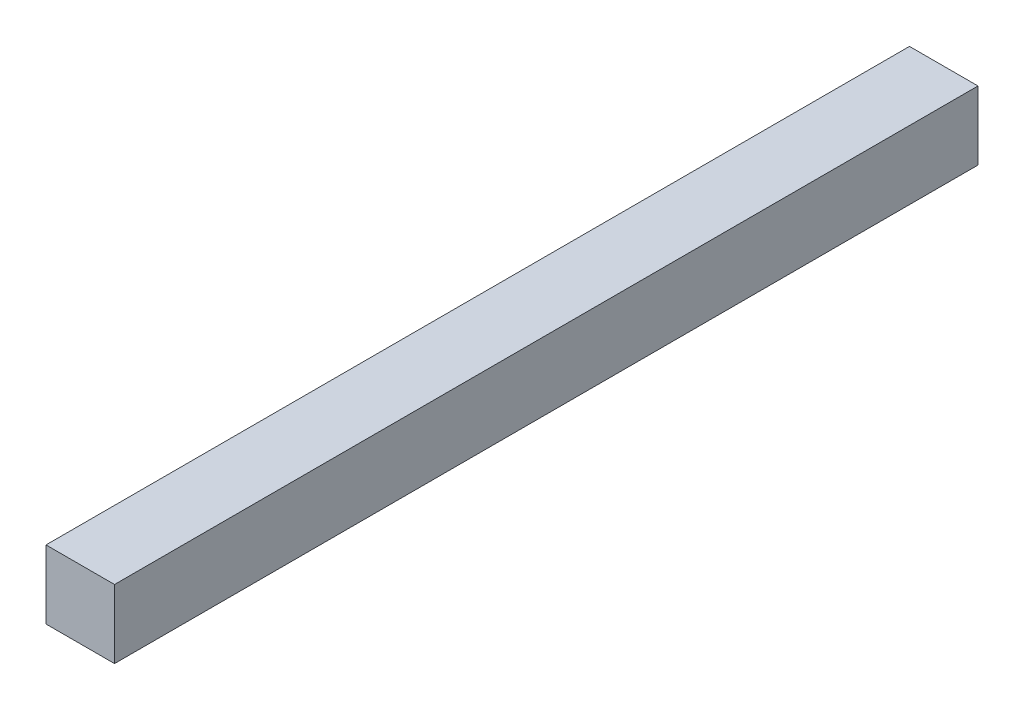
SolidWorks part; units mm, degrees
ref_plane "Front Plane" through (0, 0, 0) normal (0, 0, 1) x (1, 0, 0)
ref_plane "Top Plane" through (0, 0, 0) normal (0, 1, 0) x (1, 0, 0)
ref_plane "Right Plane" through (0, 0, 0) normal (1, 0, 0) x (0, 0, -1)
sketch "Sketch1" plane through (0, 0, 0) normal (0, 0, 1) x (1, 0, 0)
  line L1 (0, 0) -> (6.35, 0)
  line L2 (0, 0) -> (0, -6.35)
  line L3 (0, -6.35) -> (6.35, -6.35)
  line L4 (6.35, 0) -> (6.35, -6.35)
  dimension "D1" = 6.35
  dimension "D2" = 6.35
extrude "Extrude1" add sketch "Sketch1" along normal blind 80.01
